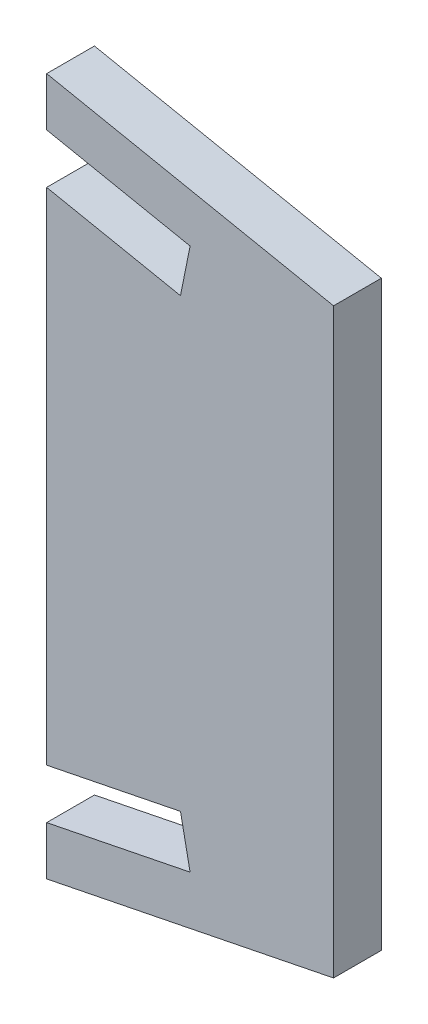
SolidWorks part; units mm, degrees
ref_plane "Plan de face" through (0, 0, 0) normal (0, 0, 1) x (1, 0, 0)
ref_plane "Plan de dessus" through (0, 0, 0) normal (0, 1, 0) x (1, 0, 0)
ref_plane "Plan de droite" through (0, 0, 0) normal (1, 0, 0) x (0, 0, -1)
sketch "Esquisse1" plane through (0, 0, 0) normal (0, 0, 1) x (1, 0, 0)
  line L1 (0, 0) -> (-60, 0)
  line L2 (0, 0) -> (0, 150)
  line L3 (0, 150) -> (-60, 150)
  line L4 (-60, 0) -> (-60, 150)
  dimension "D1" = 150
  dimension "D2" = 60
extrude "Boss.-Extru.1" add sketch "Esquisse1" along normal blind 10
sketch "Esquisse2" plane through (0, 0, 10) normal (0, 0, 1) x (1, 0, 0)
  line L5 (-60, 137.7274) -> (-30, 131.7002)
  line L6 (-60, 150) -> (-60, 0) construction
  line L7 (-30, 131.7002) -> (-32.0091, 121.7)
  line L8 (-32.0091, 121.7) -> (-60, 127.3236)
  line L9 (-60, 127.3236) -> (-60, 137.7274)
  line L10 (0, 150) -> (-60, 150) construction
  line L11 (0, 0) -> (0, 150) construction
  line L12 (-60, 75) -> (8.5132, 75) construction
  line L13 (-60, 22.6764) -> (-60, 12.2726)
  line L14 (-32.0091, 28.3) -> (-60, 22.6764)
  line L15 (-30, 18.2998) -> (-32.0091, 28.3)
  line L16 (-60, 12.2726) -> (-30, 18.2998)
  dimension "D1" = 10.2
  dimension "D2" = 11.36
  dimension "D3" = 30
  dimension "D4" = 46.7
extrude "Enlèv. mat.-Extru.1" cut sketch "Esquisse2" against normal blind 10
sketch "Esquisse3" plane through (0, 0, 10) normal (0, 0, 1) x (1, 0, 0)
  line L0 (-70.3168, 150) -> (0, 135.8727)
  line L1 (0, 150) -> (-60, 150) construction
  line L2 (0, 0) -> (0, 150) construction
  line L3 (0, 135.8727) -> (0, 150)
  line L4 (0, 150) -> (-70.3168, 150)
  line L6 (-30, 131.7002) -> (-60, 137.7274) construction
  line L7 (-60, 75) -> (10.7188, 75) construction
  line L8 (-60, 127.3236) -> (-60, 22.6764) construction
  line L9 (0, 0) -> (-70.3168, 0)
  line L10 (0, 14.1273) -> (0, 0)
  line L11 (-70.3168, 0) -> (0, 14.1273)
  dimension "D2" = 10
extrude "Enlèv. mat.-Extru.2" cut sketch "Esquisse3" against normal blind 10
